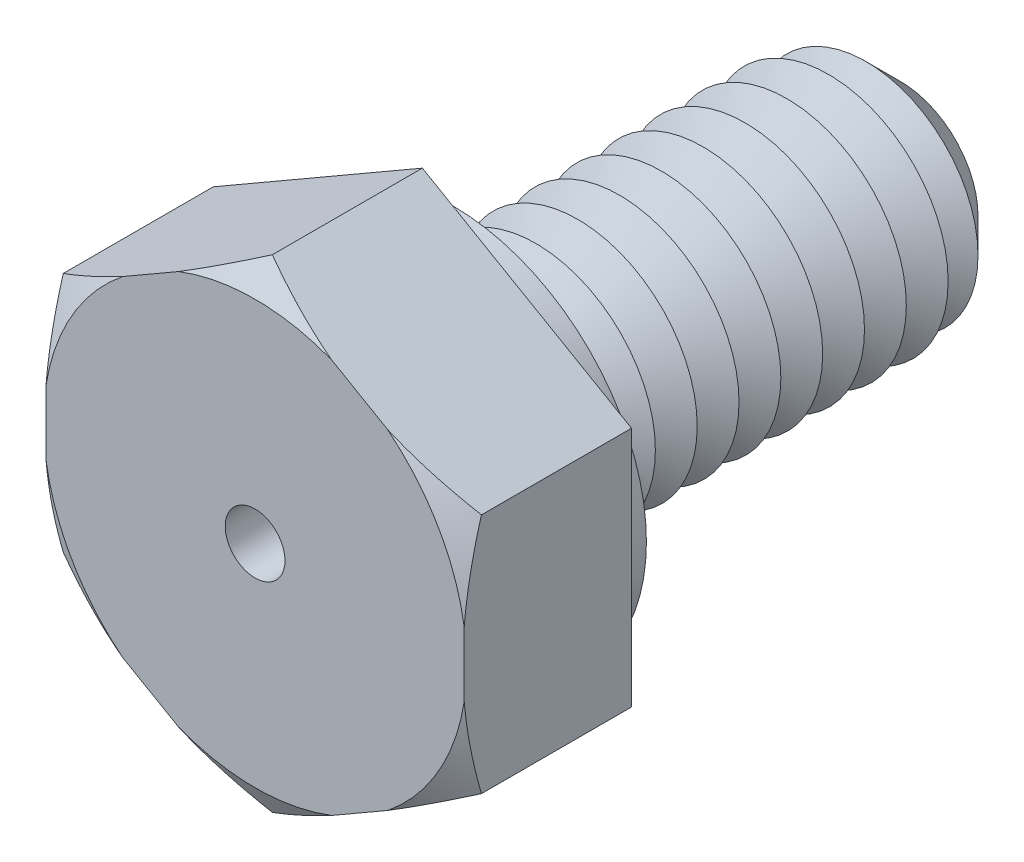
SolidWorks part; units mm, degrees
ref_plane "Front Plane" through (0, 0, 0) normal (0, 0, 1) x (1, 0, 0)
ref_plane "Top Plane" through (0, 0, 0) normal (0, 1, 0) x (1, 0, 0)
ref_plane "Right Plane" through (0, 0, 0) normal (1, 0, 0) x (0, 0, -1)
sketch "Sketch2" plane through (0, 0, 0) normal (0, 0, 1) x (1, 0, 0)
  line L1 (0, 4.0415) -> (-3.5, 2.0207)
  line L2 (-3.5, 2.0207) -> (-3.5, -2.0207)
  line L3 (-3.5, -2.0207) -> (0, -4.0415)
  line L4 (0, -4.0415) -> (3.5, -2.0207)
  line L5 (3.5, -2.0207) -> (3.5, 2.0207)
  line L6 (3.5, 2.0207) -> (0, 4.0415)
  circle A0 centre (0, 0) radius 3.5 construction
  dimension "D1" = 7
extrude "Boss-Extrude1" add sketch "Sketch2" along normal blind 2.8
sketch "Sketch3" plane through (0, 0, 0) normal (0, 0, -1) x (-1, 0, 0)
  circle A0 centre (0, 0) radius 2
  dimension "D1" = 4
extrude "Boss-Extrude2" add sketch "Sketch3" along normal blind 8
sketch "Sketch4" plane through (0, 0, 0) normal (0, 0, -1) x (-1, 0, 0)
  circle A0 centre (0, 0) radius 3.25
  dimension "D1" = 6.5
extrude "Boss-Extrude3" add sketch "Sketch4" along normal blind 0.5
sketch "Sketch5" plane through (0, 0, 0) normal (1, 0, 0) x (0, 0, -1)
  line L0 (-3.2117, 0) -> (6.3192, 0) construction
chamfer "Chamfer1" distance 0.7 angle 45 1 edges at (-2, 0, -8)
sketch "Sketch6" plane through (0, 0, 0) normal (1, 0, 0) x (0, 0, -1)
  line L0 (0.5, 2) -> (0.85, 1.3938)
  line L1 (0.85, 1.3938) -> (1.2, 2)
  line L2 (7.3, 2) -> (0.5, 2) construction
  line L3 (1.2, 2) -> (0.5, 2)
  dimension "D1" = 0.7
revolve "Cut-Revolve1" cut sketch "Sketch6" angle 360 about L0
pattern_linear "LPattern1" count 10 spacing 0.7 along (0, 0, -1) of "Cut-Revolve1"
sketch "Sketch7" plane through (0, 0, 0) normal (1, 0, 0) x (0, 0, -1)
  line L0 (-2.8, 4.0415) -> (-2.8, 3.5415)
  line L1 (-2.8, 2.0207) -> (-2.8, 4.0415) construction
  line L2 (-2.8, 3.5415) -> (-2.5113, 4.0415)
  line L3 (-2.8, 4.0415) -> (0, 4.0415) construction
  line L4 (-2.5113, 4.0415) -> (-2.8, 4.0415)
  dimension "D1" = 0.5
  dimension "D2" = 30
revolve "Cut-Revolve2" cut sketch "Sketch7" angle 360 about L0
sketch "Sketch8" plane through (0, 0, 2.8) normal (0, 0, 1) x (1, 0, 0)
  circle A0 centre (0, 0) radius 0.5
  dimension "D1" = 1
extrude "Cut-Extrude1" cut sketch "Sketch8" against normal up to surface (10.8 mm away)
